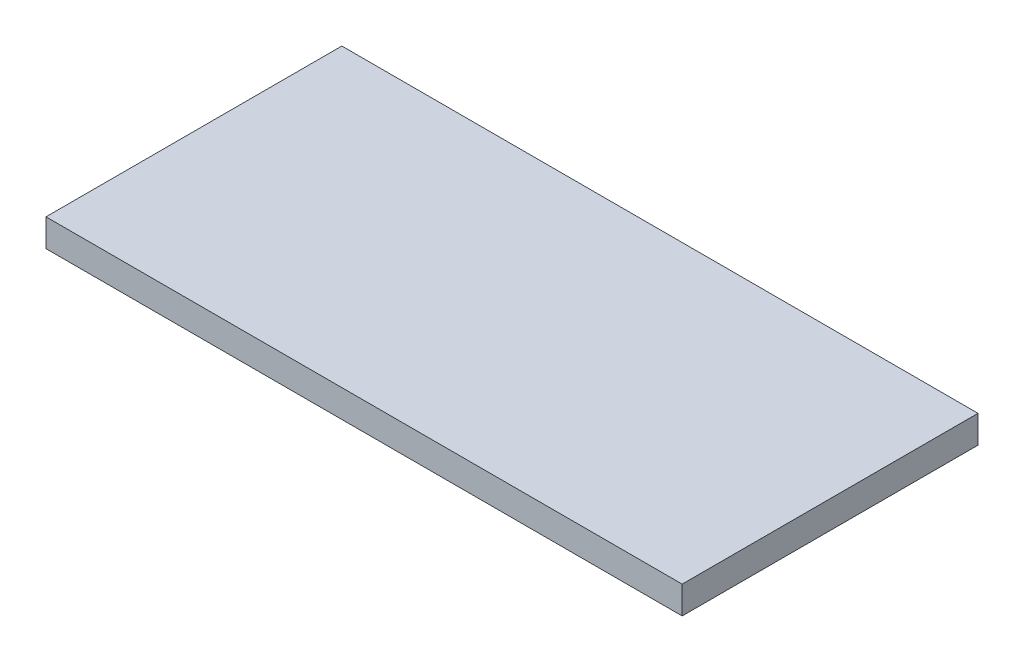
SolidWorks part; units mm, degrees
ref_plane "Front Plane" through (0, 0, 0) normal (0, 0, 1) x (1, 0, 0)
ref_plane "Top Plane" through (0, 0, 0) normal (0, 1, 0) x (1, 0, 0)
ref_plane "Right Plane" through (0, 0, 0) normal (1, 0, 0) x (0, 0, -1)
sketch "Sketch1" plane through (0, 0, 0) normal (0, 1, 0) x (1, 0, 0)
  line L0 (34.564, -16.0727) -> (-34.564, 16.0727) construction
  line L1 (-34.564, 16.0727) -> (34.564, 16.0727)
  line L2 (-34.564, 16.0727) -> (-34.564, -16.0727)
  line L3 (-34.564, -16.0727) -> (34.564, -16.0727)
  line L4 (34.564, 16.0727) -> (34.564, -16.0727)
extrude "Extrude1" add sketch "Sketch1" along normal blind 3
